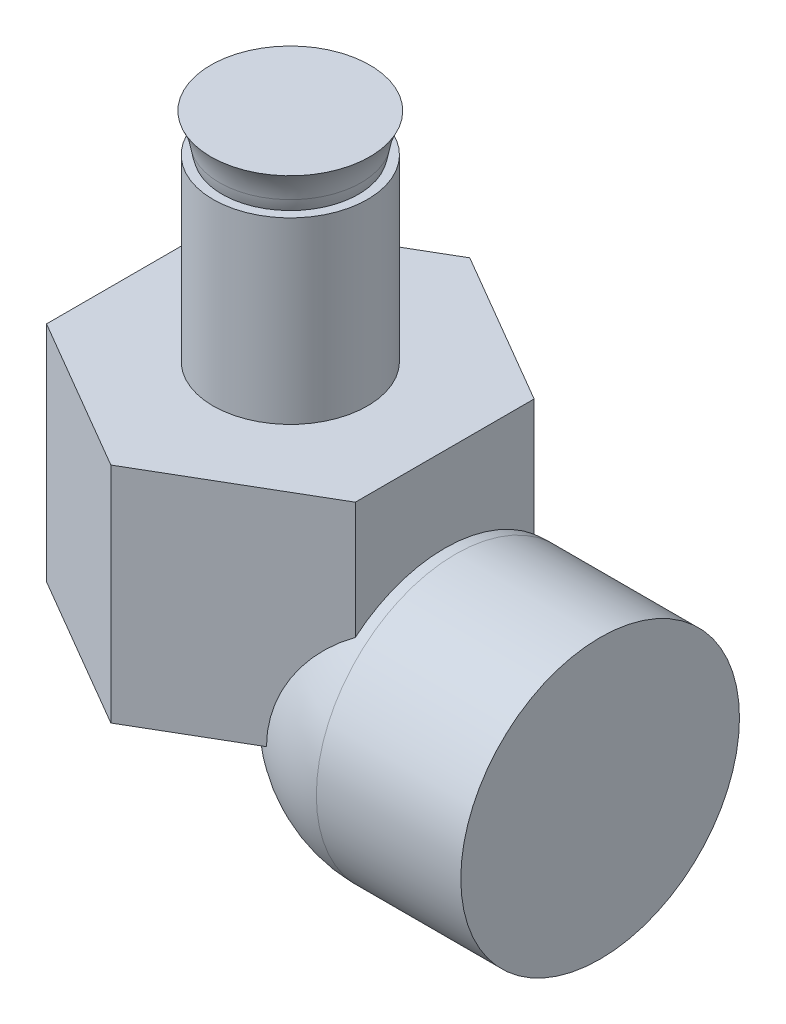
SolidWorks part; units mm, degrees
ref_plane "前视基准面" through (0, 0, 0) normal (0, 0, 1) x (1, 0, 0)
ref_plane "上视基准面" through (0, 0, 0) normal (0, 1, 0) x (1, 0, 0)
ref_plane "右视基准面" through (0, 0, 0) normal (1, 0, 0) x (0, 0, -1)
sketch "草图1" plane through (0, 0, 0) normal (0, 1, 0) x (1, 0, 0)
  line L0 (0, 76.5735) -> (0, -74.3324) construction
  line L1 (-91.3279, 0) -> (70.7838, 0) construction
  line L2 (0, 40.1543) -> (-34.5515, 20)
  line L3 (-34.5515, 20) -> (-34.5515, -20)
  line L4 (-34.5515, -20) -> (0, -40.1543)
  line L5 (-34.5515, 20) -> (44.2632, 20) construction
  line L6 (34.5515, -20) -> (0, -40.1543)
  line L7 (34.5515, 20) -> (34.5515, -20)
  line L8 (0, 40.1543) -> (34.5515, 20)
  dimension "D1" = 34.5515
  dimension "D2" = 40
  dimension "D3" = 40
  dimension "D4" = 40
  dimension "D5" = 20
extrude "拉伸1" add sketch "草图1" along normal blind 50
sketch "草图2" plane through (0, 0, 0) normal (0, 1, 0) x (1, 0, 0)
  line L0 (-29.6672, 0) -> (83.0003, 0) construction
  line L1 (37, 39.7436) -> (37, -42.2959) construction
  line L2 (0, 53.6029) -> (0, -31.1712) construction
  line L3 (37, 31.1788) -> (69.3271, 31.1788)
  line L4 (69.3271, 31.1788) -> (69.3271, 0)
  line L5 (5.8212, 0) -> (69.3271, 0)
  arc A0 (37, 31.1788) -> (5.8212, 0) centre (37, 0) ccw
  point P6 (37, 0)
  point P7 (37, 0)
  dimension "D1" = 37
revolve "旋转1" add sketch "草图2" angle 360 about L0
sketch "草图3" plane through (0, 0, 0) normal (0, 0, 1) x (1, 0, 0)
  line L0 (0, 131.4953) -> (0, -24.1394) construction
  line L1 (-17.2757, 50) -> (-17.2757, 90.0238)
  line L2 (-34.5515, 50) -> (0, 50) construction
  line L3 (-17.2757, 90.0238) -> (-15.2738, 90.0238)
  line L4 (-17.7915, 98.545) -> (0, 98.545)
  line L5 (-17.2757, 50) -> (0, 50)
  line L6 (0, 98.545) -> (0, 50)
  arc A0 (-15.2738, 90.0238) -> (-15.8408, 92.5427) centre (0, 94.7851) cw
  arc A1 (-15.8408, 92.5427) -> (-17.7915, 98.545) centre (-33.9285, 89.9823) ccw
revolve "旋转3" add sketch "草图3" angle 360 about L0
